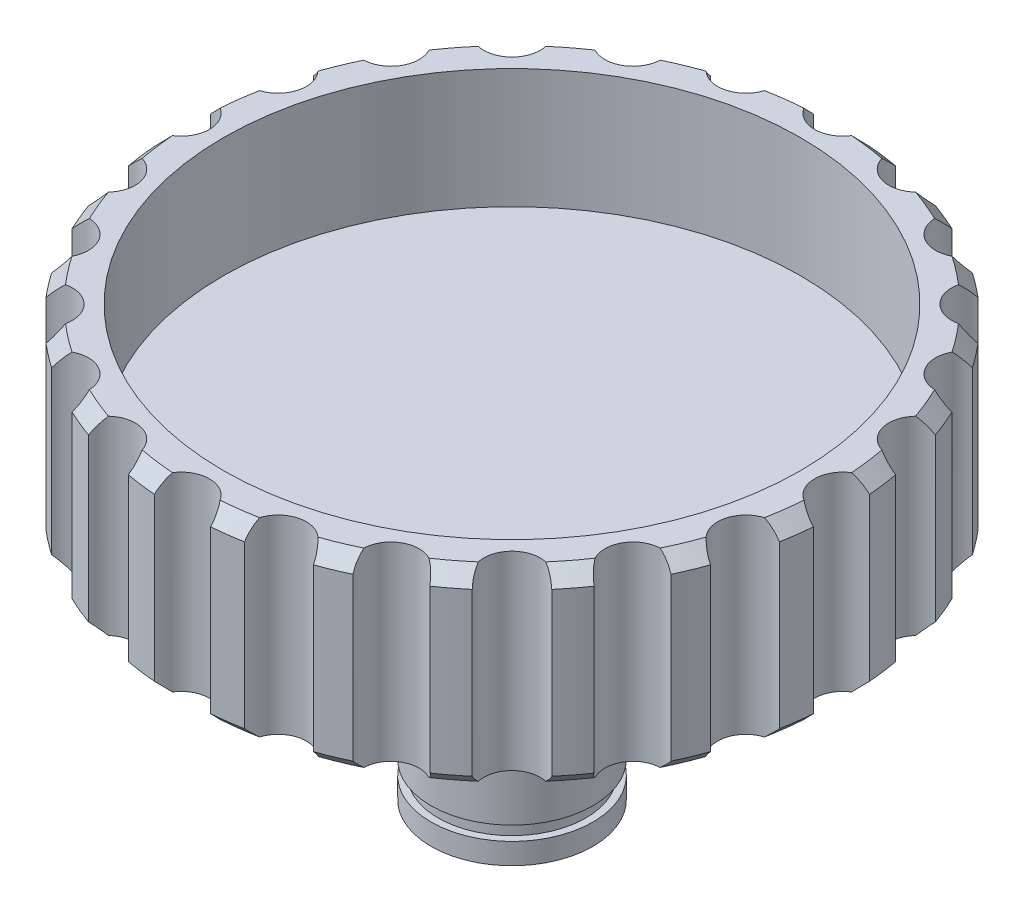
SolidWorks part; units mm, degrees
ref_plane "Front Plane" through (0, 0, 0) normal (0, 0, 1) x (1, 0, 0)
ref_plane "Top Plane" through (0, 0, 0) normal (0, 1, 0) x (1, 0, 0)
ref_plane "Right Plane" through (0, 0, 0) normal (1, 0, 0) x (0, 0, -1)
sketch "Sketch1" plane through (0, 0, 0) normal (0, 1, 0) x (1, 0, 0)
  circle A0 centre (0, 0) radius 23.5
  dimension "D1" = 47
extrude "Boss-Extrude1" add sketch "Sketch1" against normal blind 13.5
chamfer "Chamfer1" distance 1 angle 45 2 edges at (0, -13.5, 23.5) (0, 0, 23.5)
sketch "Sketch3" plane through (0, 0, 0) normal (0, 1, 0) x (1, 0, 0)
  circle A0 centre (-23.5, 0) radius 2
  circle A1 centre (0, 0) radius 23.5 construction
  dimension "D1" = 4
extrude "Cut-Extrude1" cut sketch "Sketch3" against normal through all
pattern_circular "CirPattern1" count 24 over 360 about axis through (0, 0, 0) along (0, 1, 0) of "Cut-Extrude1"
sketch "Sketch4" plane through (0, 0, 0) normal (0, 1, 0) x (1, 0, 0)
  circle A0 centre (0, 0) radius 20.5
  dimension "D1" = 41
extrude "Candle Bore" cut sketch "Sketch4" against normal blind 8.5
sketch "Sketch5" plane through (0, -13.5, 0) normal (0, -1, 0) x (1, 0, 0)
  circle A0 centre (0, 0) radius 5.75
  dimension "D1" = 11.5
extrude "Boss-Extrude2" add sketch "Sketch5" along normal blind 17
sketch "Sketch6" plane through (0, 0, 0) normal (1, 0, 0) x (0, 0, -1)
  line L0 (-5.75, -30.5) -> (5.75, -30.5) construction
  line L1 (-8.25, -28) -> (-5.25, -28)
  line L2 (-8.25, -28) -> (-8.25, -29)
  line L3 (-8.25, -29) -> (-5.25, -29)
  line L4 (-5.25, -28) -> (-5.25, -29)
  line L5 (-5.75, -13.5) -> (-5.75, -30.5) construction
  dimension "D1" = 1
  dimension "D2" = 1.5
  dimension "D3" = 3
  dimension "D4" = 0.5
revolve "O-ring groove" cut sketch "Sketch6" angle 360 about axis through (0, -30.5, 0) along (0, 1, 0)
hole_wizard "M6x1.0 Tapped Hole1" positions "Sketch10" profile "Sketch9" tap size "M6x1.0" standard "ANSI Metric"
sketch "Sketch10" plane through (0, -30.5, 0) normal (0, -1, 0) x (-1, 0, 0)
  point P0 (0, 0)
sketch "Sketch9" plane through (0, -30.5, 0) normal (1, 0, 0) x (0, 0, -1)
  line L0 (0, 0) -> (0, 20.5022)
  line L1 (0, 20.5022) -> (2.5, 19)
  line L2 (2.5, 19) -> (2.5, 0)
  line L5 (2.5, 0) -> (0, 0)
  line L10 (0, 20.5022) -> (-2.5, 19) construction
  line L11 (0, -6.35) -> (0, 107.95) construction
  dimension "Tap Drill Dia." = 5
  dimension "Tap Drill Depth" = 19
  dimension "Drill Angle" = 118
